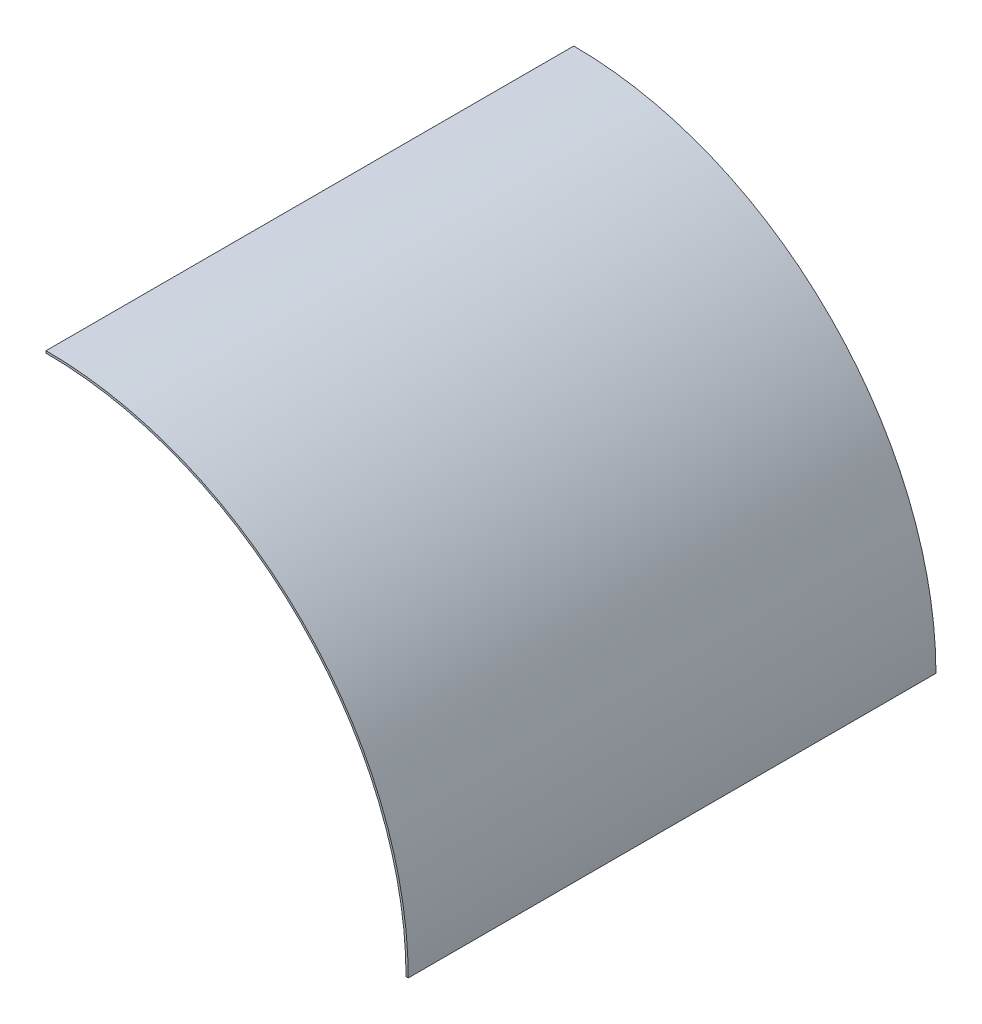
SolidWorks part; units mm, degrees
ref_plane "Front Plane" through (0, 0, 0) normal (0, 0, 1) x (1, 0, 0)
ref_plane "Top Plane" through (0, 0, 0) normal (0, 1, 0) x (1, 0, 0)
ref_plane "Right Plane" through (0, 0, 0) normal (1, 0, 0) x (0, 0, -1)
sketch "Sketch1" plane through (0, 0, 0) normal (0, 0, 1) x (1, 0, 0)
  line L0 (0, 0) -> (0, 45.174) construction
  line L1 (0, 0) -> (40.8023, 0) construction
  line L2 (0, 2059) -> (0, 2046.5)
  line L3 (2059, 0) -> (2046.5, 0)
  arc A0 (0, 2046.5) -> (2046.5, 0) centre (0, 0) cw
  arc A1 (0, 2059) -> (2059, 0) centre (0, 0) cw
  dimension "D1" = 2046.5
  dimension "D2" = 12.5
extrude "Boss-Extrude1" add sketch "Sketch1" against normal blind 3000
